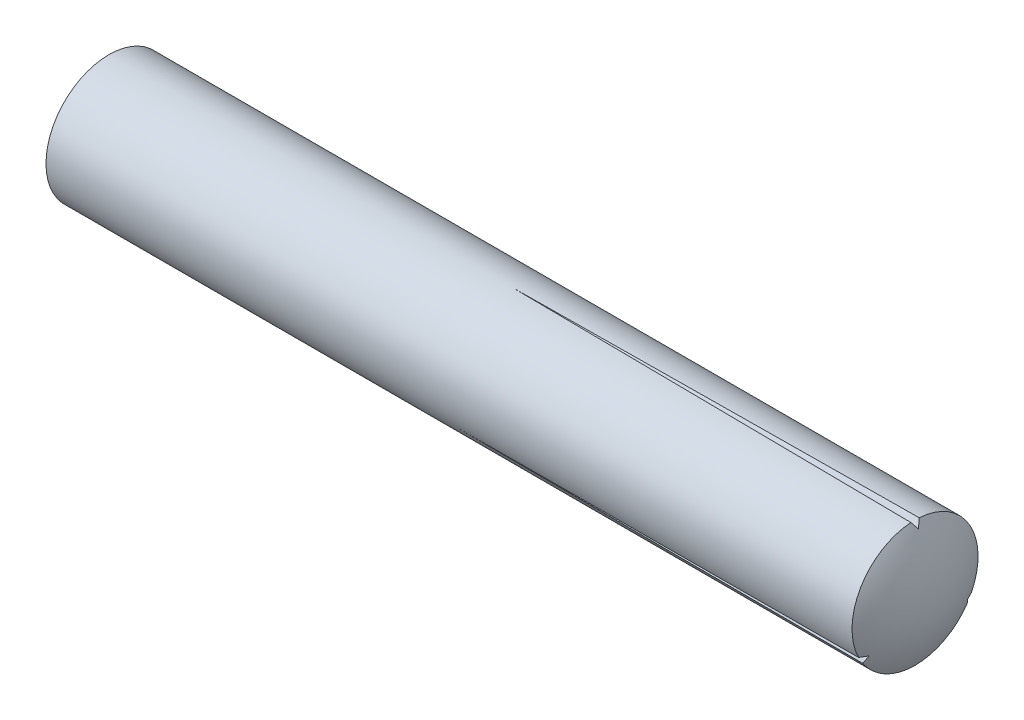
SolidWorks part; units mm, degrees
ref_plane "Front" through (0, 0, 0) normal (0, 0, 1) x (1, 0, 0)
ref_plane "Top" through (0, 0, 0) normal (0, 1, 0) x (1, 0, 0)
ref_plane "Right" through (0, 0, 0) normal (1, 0, 0) x (0, 0, -1)
sketch "Sketch1" plane through (0, 0, 0) normal (0, 0, 1) x (1, 0, 0)
  line L0 (10, 0) -> (0, 0)
  line L1 (0.201, 0.75) -> (9.799, 0.75)
  line L2 (-11.7496, 0) -> (1.4496, 0) construction
  arc A0 (0.201, 0.75) -> (0, 0) centre (1.5, 0) ccw
  arc A1 (9.799, 0.75) -> (10, 0) centre (8.5, 0) cw
  dimension "r" = 1.5
  dimension "l" = 10
  dimension "d" = 1.5
revolve "Base-Revolve" add sketch "Sketch1" angle 360 about L2
ref_plane "Plane1" through (10, 0, 0) normal (1, 0, 0) x (0, 0, -1)
sketch "Sketch2" plane through (10, 0, 0) normal (1, 0, 0) x (0, 0, -1)
  line L0 (-0.0525, 0.75) -> (0, 0.675)
  line L1 (0, 0.675) -> (0.0525, 0.75)
  line L2 (-0.0525, 0.75) -> (0.0525, 0.75)
  line L3 (0, 0.9637) -> (0, -0.1519) construction
  dimension "D1" = 70
  dimension "D2" = 35
  dimension "D3" = 0.75
  dimension "D4" = 0.675
sketch "Sketch3" plane through (0, 0, 0) normal (1, 0, 0) x (0, 0, -1)
  point P0 (0, 0.75)
  dimension "D1" = 0.75
loft "Cut-Loft1" [suppressed] cut profiles "Sketch2", "Sketch3"
pattern_circular "CirPattern1" [suppressed] count 3 over 360 about axis through (-11.7496, 0, 0) along (1, 0, 0)
ref_plane "Plane2" through (5, 0, 0) normal (1, 0, 0) x (0, 0, -1)
sketch "Sketch5" plane through (5, 0, 0) normal (1, 0, 0) x (0, 0, -1)
  point P0 (0, 0.75)
  dimension "D1" = 0.75
sketch "Sketch4" plane through (10, 0, 0) normal (1, 0, 0) x (0, 0, -1)
  line L0 (-0.0525, 0.75) -> (0, 0.675)
  line L1 (0, 0.675) -> (0.0525, 0.75)
  line L2 (0.0525, 0.75) -> (-0.0525, 0.75)
  line L3 (0, 0.8531) -> (0, -0.1202) construction
  dimension "D1" = 70
  dimension "D2" = 35
  dimension "D3" = 0.75
  dimension "D4" = 0.675
loft "Cut-Loft2" cut profiles "Sketch5", "Sketch4"
pattern_circular "CirPattern2" count 3 over 360 about axis through (0, 0, 0) along (1, 0, 0) of "Cut-Loft2"
equation "\"r@Sketch1\" = \"d@Sketch1\""
equation "\"D3@Sketch2\" = \"d@Sketch1\" / 2"
equation "\"D4@Sketch2\" = \"D3@Sketch2\" * 0.9"
equation "\"D1@Sketch3\" = \"d@Sketch1\" / 2"
equation "\"D3@Sketch4\" = \"d@Sketch1\" / 2"
equation "\"D4@Sketch4\" = \"D3@Sketch4\" * 0.9"
equation "\"D1@Sketch5\" = \"d@Sketch1\" / 2"
